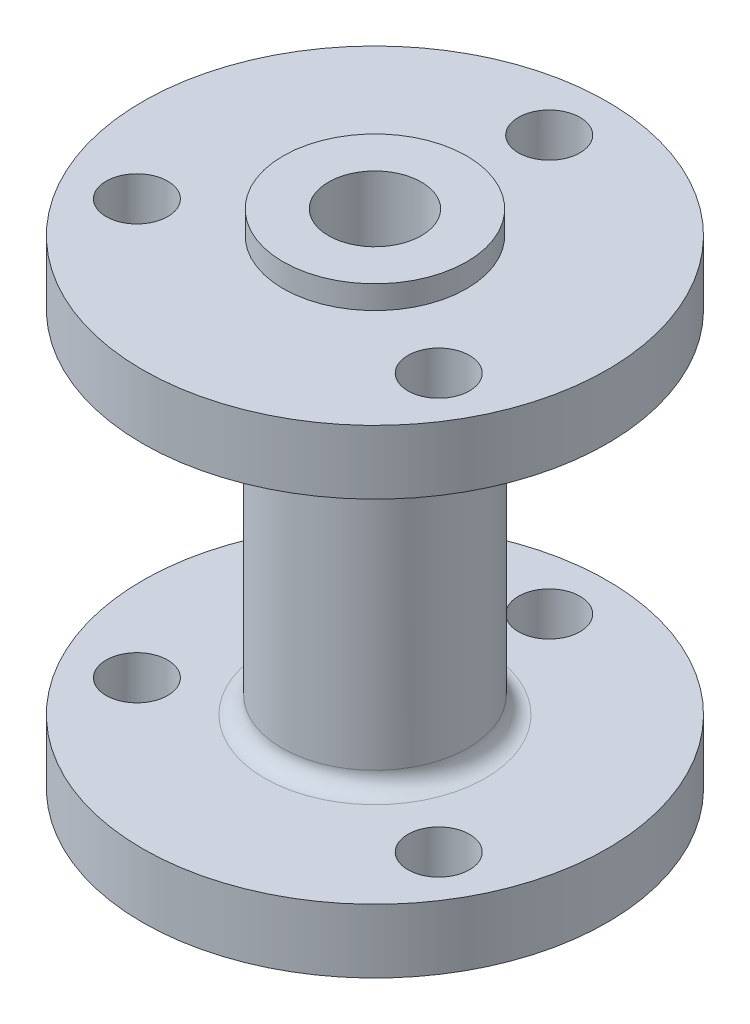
SolidWorks part; units mm, degrees
ref_plane "Front" through (0, 0, 0) normal (0, 0, 1) x (1, 0, 0)
ref_plane "Top" through (0, 0, 0) normal (0, 1, 0) x (1, 0, 0)
ref_plane "Right" through (0, 0, 0) normal (1, 0, 0) x (0, 0, -1)
ref_axis "Axis1" through (0, 50, 0) along (0, -1, 0)
sketch "Sketch1" plane through (0, 0, 0) normal (1, 0, 0) x (0, 0, -1)
  line L0 (0, 22.6) -> (-7.9, 22.6)
  line L1 (-7.9, 22.6) -> (-7.9, 20.6)
  line L2 (-7.9, 20.6) -> (-20, 20.6)
  line L3 (-20, 20.6) -> (-20, 15.1)
  line L4 (-20, 15.1) -> (-8, 15.1)
  line L5 (-8, 15.1) -> (-8, -15.1)
  line L6 (-8, -15.1) -> (-20, -15.1)
  line L7 (-20, -15.1) -> (-20, -20.6)
  line L8 (-20, -20.6) -> (-7.9, -20.6)
  line L9 (-7.9, -20.6) -> (-7.9, -22.6)
  line L10 (-7.9, -22.6) -> (0, -22.6)
  line L11 (0, -22.6) -> (0, 22.6)
  point P11 (0, 0)
  dimension "D1" = 20
  dimension "D2" = 5.5
  dimension "D3" = 8
  dimension "D4" = 45.2
  dimension "D5" = 2
  dimension "D6" = 7.9
sketch "Sketch2" plane through (0, 0, 0) normal (1, 0, 0) x (0, 0, -1)
  line L12 (0, 22.6) -> (-7.9, 22.6)
  line L13 (-7.9, 22.6) -> (-7.9, 20.6)
  line L14 (-7.9, 20.6) -> (-20, 20.6)
  line L15 (-20, 20.6) -> (-20, 15.1)
  line L16 (-20, 15.1) -> (-8, 15.1)
  line L17 (-8, 15.1) -> (-8, -15.1)
  line L18 (-8, -15.1) -> (-20, -15.1)
  line L19 (-20, -15.1) -> (-20, -20.6)
  line L20 (-20, -20.6) -> (-7.9, -20.6)
  line L21 (-7.9, -20.6) -> (-7.9, -22.6)
  line L22 (-7.9, -22.6) -> (0, -22.6)
  line L23 (0, -22.6) -> (0, 22.6)
  line L24 (0, 22.6) -> (-7.9, 22.6)
  line L25 (-7.9, 22.6) -> (-7.9, 20.6)
  line L26 (-7.9, 20.6) -> (-20, 20.6)
  line L27 (-20, 20.6) -> (-20, 15.1)
  line L28 (-20, 15.1) -> (-8, 15.1)
  line L29 (-8, 15.1) -> (-8, -15.1)
  line L30 (-8, -15.1) -> (-20, -15.1)
  line L31 (-20, -15.1) -> (-20, -20.6)
  line L32 (-20, -20.6) -> (-7.9, -20.6)
  line L33 (-7.9, -20.6) -> (-7.9, -22.6)
  line L34 (-7.9, -22.6) -> (0, -22.6)
  line L35 (0, -22.6) -> (0, 22.6)
  dimension "D1" = 0
revolve "Revolve1" add sketch "Sketch2" angle 360 about axis through (0, 50, 0) along (0, -1, 0)
sketch "Sketch3" plane through (0, 0, 0) normal (0, 1, 0) x (1, 0, 0)
  circle A0 centre (0, 0) radius 15 construction
  point P0 (0, 0)
  point P4 (0, 15)
  dimension "D1" = 30
hole_wizard "Ø8.0mm Dowel Hole1" positions "Sketch4" profile "Sketch5" hole size "Ø8.0" standard "ANSI Metric"
sketch "Sketch4" plane through (0, 22.6, 0) normal (0, 1, 0) x (1, 0, 0)
  point P0 (0, 0)
sketch "Sketch5" plane through (0, 22.6, 0) normal (1, 0, 0) x (0, 0, 1)
  line L0 (0, 0) -> (0, 45.2)
  line L1 (0, 45.2) -> (4, 45.2)
  line L2 (4, 45.2) -> (4, 0)
  line L5 (4, 0) -> (0, 0)
  line L11 (0, -6.35) -> (0, 107.95) construction
  dimension "Thru Hole Dia." = 8
  dimension "Thru Hole Depth" = 45.2
hole_wizard "M5 Clearance Hole1" positions "Sketch6" profile "Sketch7" hole size "M5" standard "ANSI Metric"
sketch "Sketch6" plane through (0, 20.6, 0) normal (0, 1, 0) x (1, 0, 0)
  point P0 (0, 15)
sketch "Sketch7" plane through (0, 20.6, -15) normal (1, 0, 0) x (0, 0, 1)
  line L0 (0, 0) -> (0, 43.2)
  line L1 (0, 43.2) -> (2.65, 43.2)
  line L2 (2.65, 43.2) -> (2.65, 0)
  line L5 (2.65, 0) -> (0, 0)
  line L11 (0, -6.35) -> (0, 107.95) construction
  dimension "Thru Hole Dia." = 5.3
  dimension "Thru Hole Depth" = 43.2
pattern_circular "CirPattern1" count 3 over 360 about axis through (0, 0, 0) along (0, 1, 0) of "M5 Clearance Hole1"
fillet "Fillet1" radius 1.5 2 edges at (0, -15.1, 8) (0, 15.1, 8)
sketch "Sketch8" [suppressed] plane through (0, 0, 0) normal (1, 0, 0) x (0, 0, -1)
  line L0 (7.9, 19.6) -> (-7.9, 19.6) construction
  line L1 (-6.4008, 19.6) -> (-4.2672, 19.6)
  line L2 (-6.4008, 19.6) -> (-6.4008, 18.2792)
  line L3 (-6.4008, 18.2792) -> (-4.2672, 18.2792)
  line L4 (-4.2672, 19.6) -> (-4.2672, 18.2792)
  line L5 (-6.4008, 19.6) -> (-4.2672, 18.2792) construction
  line L6 (-6.4008, 18.2792) -> (-4.2672, 19.6) construction
  line L7 (0, 50) -> (0, -50) construction
  point P4 (-5.334, 18.9396)
  dimension "D1" = 6.4008
  dimension "D2" = 2.1336
  dimension "D3" = 1.3208
sketch "Sketch9" [suppressed] plane through (0, 0, 0) normal (1, 0, 0) x (0, 0, -1)
  line L4 (-4.2672, 19.6) -> (-6.4008, 19.6)
  line L5 (-4.2672, 18.2792) -> (-4.2672, 19.6)
  line L6 (-6.4008, 18.2792) -> (-4.2672, 18.2792)
  line L7 (-6.4008, 19.6) -> (-6.4008, 18.2792)
  line L8 (-4.2672, 19.6) -> (-6.4008, 19.6)
  line L9 (-4.2672, 18.2792) -> (-4.2672, 19.6)
  line L10 (-6.4008, 18.2792) -> (-4.2672, 18.2792)
  line L11 (-6.4008, 19.6) -> (-6.4008, 18.2792)
  dimension "D1" = 0
revolve "Cut-Revolve1" [suppressed] cut sketch "Sketch9" angle 360 about axis through (0, 50, 0) along (0, -1, 0)
sketch "Sketch10" plane through (0, 0, 0) normal (0, 1, 0) x (1, 0, 0)
  circle A0 centre (0, 15) radius 4.25 construction
  circle A1 centre (0, 0) radius 10 construction
  dimension "D1" = 8.5
  dimension "D2" = 20
